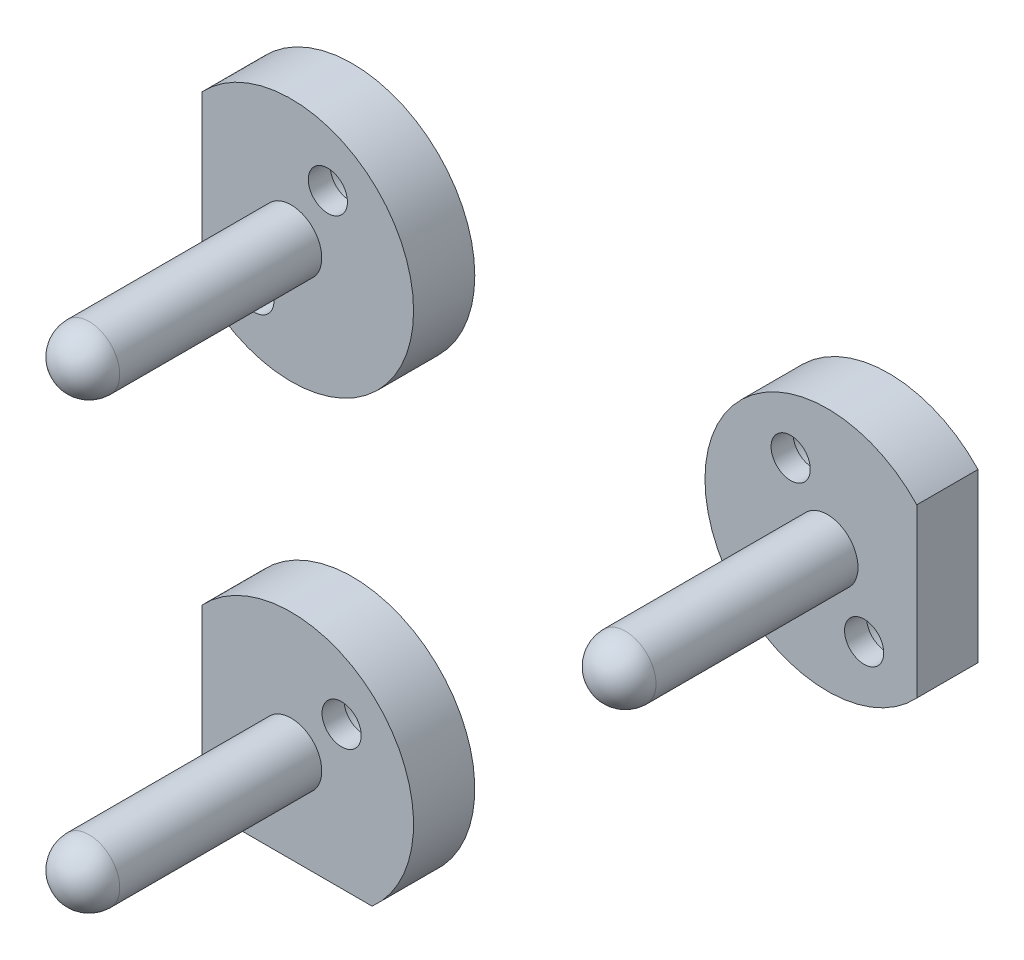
SolidWorks part; units mm, degrees
ref_plane "前基準面" through (0, 0, 0) normal (0, 0, 1) x (1, 0, 0)
ref_plane "上基準面" through (0, 0, 0) normal (0, 1, 0) x (1, 0, 0)
ref_plane "右基準面" through (0, 0, 0) normal (1, 0, 0) x (0, 0, -1)
sketch "草圖1" plane through (0, 0, 0) normal (0, 0, 1) x (1, 0, 0)
  line L0 (0, 26.9) -> (0, -26.9) construction
  line L1 (-34.9, 26.9) -> (34.9, 26.9) construction
  line L2 (-34.9, 26.9) -> (-34.9, -26.9) construction
  line L3 (-34.9, -26.9) -> (34.9, -26.9) construction
  line L4 (34.9, 26.9) -> (34.9, -26.9) construction
  line L5 (-34.9, 26.9) -> (34.9, -26.9) construction
  line L6 (-34.9, -26.9) -> (34.9, 26.9) construction
  circle A0 centre (-21.9, 16.9) radius 10
  circle A1 centre (-21.9, -19.4) radius 10
  circle A2 centre (21.9, 16.9) radius 10
  point P0 (0, 0)
  dimension "D5" = 20
  dimension "D6" = 20
  dimension "D1" = 69.8
  dimension "D2" = 53.8
  dimension "D3" = 10
  dimension "D4" = 13
  dimension "D7" = 7.5
extrude "填料-伸長1" add sketch "草圖1" along normal blind 5
sketch "草圖2" plane through (0, 0, 5) normal (0, 0, 1) x (1, 0, 0)
  circle A0 centre (-21.9, 16.9) radius 2.5
  circle A1 centre (21.9, 16.9) radius 2.5
  circle A2 centre (-21.9, -19.4) radius 2.5
  dimension "D1" = 5
  dimension "D2" = 5
  dimension "D3" = 5
extrude "填料-伸長2" add sketch "草圖2" along normal blind 19
ref_plane "平面1" through (-24.9, 0, 0) normal (1, 0, 0) x (0, 0, -1)
fillet "圓角4" radius 2.5 1 edges at (-19.4, 16.9, 24)
fillet "圓角5" radius 2.5 1 edges at (-19.4, -19.4, 24)
fillet "圓角6" radius 2.5 1 edges at (24.4, 16.9, 24)
sketch "草圖4" plane through (0, 0, 0) normal (0, 0, -1) x (-1, 0, 0)
  line L0 (31.9, -19.4) -> (11.9, -19.4) construction
  line L1 (21.9, -19.4) -> (21.9, 16.9) construction
  line L2 (15.2856, -26.9) -> (28.5144, -26.9)
  line L3 (29.2, -12.5655) -> (29.2, -26.2345)
  line L4 (29.2, 23.7345) -> (29.2, 10.0655)
  line L5 (-21.9, 26.9) -> (-21.9, 6.9) construction
  line L6 (-29.2, 23.7345) -> (-29.2, 10.0655)
  circle A0 centre (21.9, -19.4) radius 10 construction
  arc A1 (28.5144, -26.9) -> (15.2856, -26.9) centre (21.9, -19.4) cw
  arc A2 (29.2, -12.5655) -> (29.2, -26.2345) centre (21.9, -19.4) cw
  circle A3 centre (21.9, 16.9) radius 10 construction
  arc A4 (29.2, 23.7345) -> (29.2, 10.0655) centre (21.9, 16.9) cw
  circle A5 centre (-21.9, 16.9) radius 10 construction
  arc A6 (-29.2, 23.7345) -> (-29.2, 10.0655) centre (-21.9, 16.9) ccw
  point P8 (21.9, -19.4)
  dimension "D1" = 7.5
  dimension "D2" = 7.3
  dimension "D3" = 7.3
extrude "除料-伸長1" cut sketch "草圖4" against normal blind 10 contours L2 M3 | A6 L6 | A4 L4 | A2 L3
sketch "草圖5" plane through (0, 0, 0) normal (0, 0, -1) x (-1, 0, 0)
  line L0 (-21.9, 16.9) -> (21.9, 16.9) construction
  line L1 (21.9, 16.9) -> (21.9, -19.4) construction
  line L2 (0, 29.5747) -> (0, -30.7013) construction
  line L3 (17.7769, -15.2769) -> (26.0231, -23.5231) construction
  circle A0 centre (-18.9, 21.9) radius 2.85
  circle A1 centre (26.0231, -23.5231) radius 2.85
  circle A2 centre (-24.9, 11.9) radius 2.85
  circle A3 centre (-21.9, 16.9) radius 2.5 construction
  circle A4 centre (24.9, 11.9) radius 2.85
  circle A5 centre (18.9, 21.9) radius 2.85
  circle A6 centre (17.7769, -15.2769) radius 2.85
  dimension "D1" = 5.7
  dimension "D5" = 5.7
  dimension "D8" = 5
  dimension "D10" = 5.7
  dimension "D11" = 5.7
  dimension "D2" = 45
  dimension "D3" = 5
  dimension "D4" = 3
  dimension "D6" = 5
  dimension "D7" = 3
  dimension "D9" = 11.6619
extrude "除料-伸長2" cut sketch "草圖5" against normal blind 3.2
sketch "草圖6" plane through (0, 0, 3.2) normal (0, 0, -1) x (-1, 0, 0)
  circle A0 centre (-18.9, 21.9) radius 1.6
  circle A1 centre (-24.9, 11.9) radius 1.6
  circle A2 centre (18.9, 21.9) radius 1.6
  circle A3 centre (24.9, 11.9) radius 1.6
  circle A4 centre (17.7769, -15.2769) radius 1.6
  circle A5 centre (26.0231, -23.5231) radius 1.6
  dimension "D1" = 3.2
  dimension "D2" = 3.2
  dimension "D3" = 3.2
  dimension "D4" = 3.2
  dimension "D5" = 3.2
  dimension "D6" = 3.2
extrude "除料-伸長3" cut sketch "草圖6" against normal up to next
